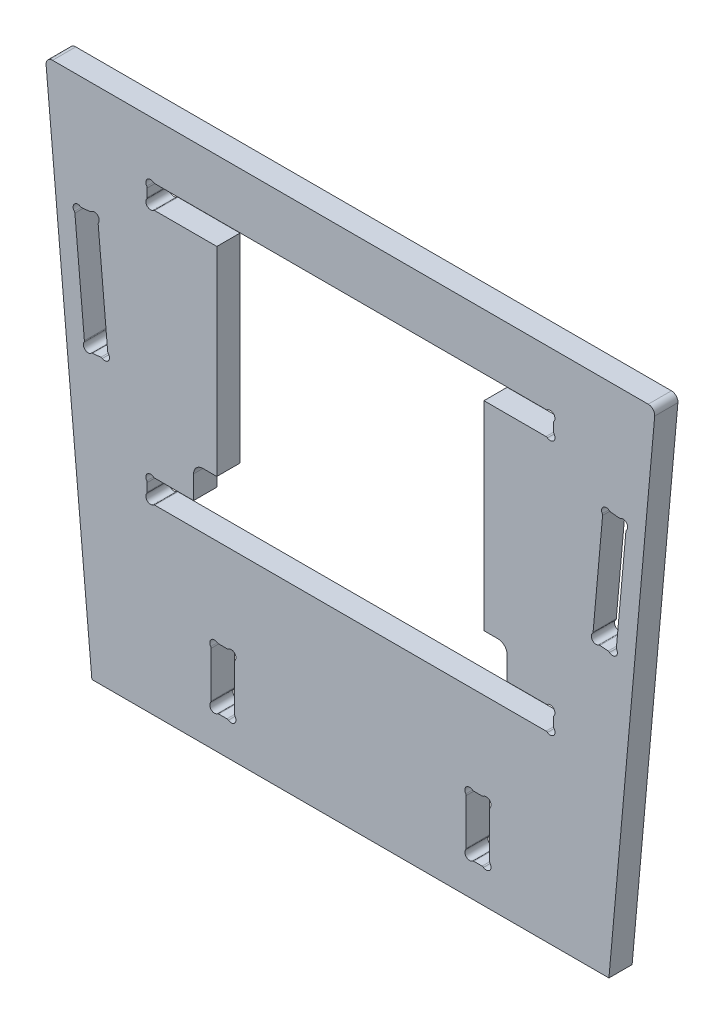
SolidWorks part; units mm, degrees
ref_plane "Front Plane" through (0, 0, 0) normal (0, 0, 1) x (1, 0, 0)
ref_plane "Top Plane" through (0, 0, 0) normal (0, 1, 0) x (1, 0, 0)
ref_plane "Right Plane" through (0, 0, 0) normal (1, 0, 0) x (0, 0, -1)
sketch "Sketch1" plane through (0, 0, 0) normal (0, 0, 1) x (1, 0, 0)
  line L0 (0, 0) -> (-50, 556.5)
  line L2 (278.5, 0) -> (0, 0)
  line L3 (-50, 556.5) -> (278.5, 556.5)
  line L4 (72.2163, 483.9) -> (59.6163, 483.9) construction
  line L5 (134.6163, 471.3) -> (67.7473, 471.3)
  line L6 (278.5, 496.5) -> (67.7473, 496.5)
  line L7 (59.6163, 488.369) -> (59.6163, 479.431)
  line L8 (59.6163, 496.5) -> (72.2163, 483.9) construction
  line L9 (72.2163, 209.1) -> (59.6163, 209.1) construction
  line L10 (278.5, 196.5) -> (67.7473, 196.5)
  line L11 (-50, 556.5) -> (-50, 0) construction
  line L12 (59.6163, 213.569) -> (59.6163, 204.631)
  line L13 (59.6163, 221.7) -> (72.2163, 209.1) construction
  line L14 (134.6163, 471.3) -> (134.6163, 256.7)
  line L15 (278.5, 556.5) -> (278.5, 496.5)
  line L16 (278.5, 196.5) -> (278.5, 0)
  line L17 (109.6163, 221.7) -> (67.7473, 221.7)
  line L18 (0, 0) -> (557, 0) construction
  line L19 (-49.3148, 556.5) -> (1124.6852, 556.5) construction
  line L20 (134.6163, 256.7) -> (119.6163, 256.7)
  line L21 (109.6163, 246.7) -> (109.6163, 221.7)
  line L22 (419.1275, 321.6195) -> (139.4282, 334.5926) construction
  line L23 (257.7921, 496.5) -> (257.7921, 486.5) construction
  line L25 (257.7921, 486.5) -> (257.7921, 206.5) construction
  line L26 (278.5, 496.5) -> (278.5, 196.5) construction
  line L31 (134.7163, 413.4756) -> (134.7163, 346.5) construction
  line L32 (257.7921, 206.5) -> (257.7921, 196.5) construction
  line L33 (422.2837, 346.5) -> (421.1254, 321.5268) construction
  line L34 (422.2837, 346.5) -> (165.5597, 358.4074) construction
  line L35 (421.1254, 321.5268) -> (419.1275, 321.6195) construction
  line L36 (140.5865, 359.5657) -> (139.4282, 334.5926) construction
  line L37 (139.4282, 334.5926) -> (165.5597, 358.4074) construction
  line L38 (422.2837, 346.5) -> (134.7163, 346.5) construction
  line L39 (165.5597, 358.4074) -> (140.5865, 359.5657) construction
  arc A0 (66.2589, 496.9914) -> (59.1249, 489.8574) centre (63.2225, 492.8938) ccw
  arc A1 (66.2589, 496.9914) -> (67.7473, 496.5) centre (67.7473, 499) ccw
  arc A2 (59.1249, 489.8574) -> (59.6163, 488.369) centre (57.1163, 488.369) cw
  arc A3 (59.1249, 477.9426) -> (59.6163, 479.431) centre (57.1163, 479.431) ccw
  arc A4 (66.2589, 470.8086) -> (59.1249, 477.9426) centre (63.2225, 474.9062) cw
  arc A5 (66.2589, 470.8086) -> (67.7473, 471.3) centre (67.7473, 468.8) cw
  arc A6 (66.2589, 222.1914) -> (59.1249, 215.0574) centre (63.2225, 218.0938) ccw
  arc A7 (66.2589, 222.1914) -> (67.7473, 221.7) centre (67.7473, 224.2) ccw
  arc A8 (59.1249, 215.0574) -> (59.6163, 213.569) centre (57.1163, 213.569) cw
  arc A9 (59.1249, 203.1426) -> (59.6163, 204.631) centre (57.1163, 204.631) ccw
  arc A10 (66.2589, 196.0086) -> (59.1249, 203.1426) centre (63.2225, 200.1062) cw
  arc A11 (66.2589, 196.0086) -> (67.7473, 196.5) centre (67.7473, 194) cw
  arc A12 (119.6163, 256.7) -> (109.6163, 246.7) centre (119.6163, 246.7) ccw
  circle A13 centre (152.494, 346.5) radius 17.6777 construction
  circle A14 centre (152.494, 346.5) radius 17.7777 construction
  point P19 (59.6163, 483.9)
  point P40 (59.6163, 209.1)
  point P46 (278.5, 0)
  point P80 (278.5, 346.5)
extrude "Boss-Extrude1" add sketch "Sketch1" along normal blind 25 contours L2 L0 L3 L15 L6 A1 A0 A2 L7 A3 A4 A5 L5 L14 L20 A12 L21 L17 A7 A6 A8 L12 A9 A10 A11 L10 L16
sketch "Sketch2" plane through (0, 0, 0) normal (0, 0, 1) x (1, 0, 0)
  line L0 (32.6309, 0) -> (5.2203, 305.0807) construction
  line L1 (278.5, 0) -> (0, 0) construction
  line L3 (278.5, 0) -> (0, 0) construction
  line L4 (6.8103, 428.1858) -> (17.0421, 314.3066)
  line L5 (-13.1727, 368.9912) -> (11.9262, 371.2462) construction
  line L6 (-18.2886, 425.9308) -> (-8.0568, 312.0516)
  line L7 (0.7692, 304.6808) -> (9.6713, 305.4806)
  line L8 (-10.9178, 434.7568) -> (-2.0157, 435.5566)
  line L9 (-4.0601, 307.8676) -> (-7.3292, 303.9531) construction
  line L10 (108.5, 0) -> (108.5, 196.5) construction
  line L11 (0, 0) -> (-50, 556.5) construction
  line L12 (278.5, 0) -> (0, 0) construction
  line L13 (6.0827, 436.2842) -> (-4.7183, 556.5) construction
  line L14 (-50, 556.5) -> (278.5, 556.5) construction
  line L15 (278.5, 196.5) -> (67.7473, 196.5) construction
  line L16 (278.5, 196.5) -> (278.5, 0) construction
  line L17 (6.0917, 436.1846) -> (-19.0072, 433.9296) construction
  line L18 (-18.9166, 434.0381) -> (-7.2296, 303.9621) construction
  line L19 (0, 0) -> (-50, 556.5) construction
  line L28 (141.1, 88.9) -> (141.1, 101.5) construction
  line L29 (128.5, 44.231) -> (128.5, 93.369)
  line L30 (145.569, 36.1) -> (136.631, 36.1)
  line L31 (153.7, 68.8) -> (128.5, 68.8) construction
  line L32 (153.7, 44.231) -> (153.7, 93.369)
  line L33 (145.569, 101.5) -> (136.631, 101.5)
  line L34 (153.7, 101.5) -> (141.1, 88.9) construction
  arc A0 (-8.413, 310.5251) -> (-0.6693, 304.0582) centre (-4.0601, 307.8676) ccw
  arc A1 (-8.413, 310.5251) -> (-8.0568, 312.0516) centre (-10.5468, 311.8278) ccw
  arc A2 (-0.6693, 304.0582) -> (0.7692, 304.6808) centre (0.9929, 302.1908) cw
  arc A3 (11.1977, 305.1244) -> (9.6713, 305.4806) centre (9.895, 302.9906) ccw
  arc A5 (17.6647, 312.8682) -> (11.1977, 305.1244) centre (13.8552, 309.4773) cw
  arc A7 (17.6647, 312.8682) -> (17.0421, 314.3066) centre (19.5321, 314.5303) cw
  arc A8 (7.1665, 429.7122) -> (6.8103, 428.1858) centre (9.3003, 428.4095) ccw
  arc A9 (7.1665, 429.7122) -> (-0.5772, 436.1792) centre (2.8137, 432.3698) ccw
  arc A10 (-0.5772, 436.1792) -> (-2.0157, 435.5566) centre (-2.2394, 438.0466) cw
  arc A11 (-12.4442, 435.113) -> (-10.9178, 434.7568) centre (-11.1415, 437.2468) ccw
  arc A12 (-18.9111, 427.3692) -> (-12.4442, 435.113) centre (-15.1017, 430.7601) cw
  arc A13 (-18.9111, 427.3692) -> (-18.2886, 425.9308) centre (-20.7785, 425.707) cw
  arc A38 (154.1914, 94.8574) -> (147.0574, 101.9914) centre (150.0938, 97.8938) ccw
  arc A39 (154.1914, 94.8574) -> (153.7, 93.369) centre (156.2, 93.369) ccw
  arc A40 (147.0574, 101.9914) -> (145.569, 101.5) centre (145.569, 104) cw
  arc A41 (135.1426, 101.9914) -> (136.631, 101.5) centre (136.631, 104) ccw
  arc A42 (128.0086, 94.8574) -> (135.1426, 101.9914) centre (132.1062, 97.8938) cw
  arc A43 (128.0086, 94.8574) -> (128.5, 93.369) centre (126, 93.369) cw
  arc A44 (128.0086, 42.7426) -> (128.5, 44.231) centre (126, 44.231) ccw
  arc A45 (128.0086, 42.7426) -> (135.1426, 35.6086) centre (132.1062, 39.7062) ccw
  arc A46 (135.1426, 35.6086) -> (136.631, 36.1) centre (136.631, 33.6) cw
  arc A47 (147.0574, 35.6086) -> (145.569, 36.1) centre (145.569, 33.6) ccw
  arc A48 (154.1914, 42.7426) -> (147.0574, 35.6086) centre (150.0938, 39.7062) cw
  arc A49 (154.1914, 42.7426) -> (153.7, 44.231) centre (156.2, 44.231) cw
  point P21 (5.2203, 305.0807)
  point P126 (141.1, 101.5)
extrude "Cut-Extrude1" cut sketch "Sketch2" along normal through all
fillet "Fillet1" radius 7 1 edges at (-50, 556.5, 12.5)
mirror "Symétrie1" about plane through (278.5, 556.5, 25) normal (1, 0, 0)
ref_plane "Plane1" through (278.5, 0, 0) normal (-1, 0, 0) x (0, 0, 1)
equation "\"tool_diameter\"=10"
equation "\"hole_clearance\"=0.1"
equation "\"material_thickness\"=25"
equation "\"clearance\"=0.1"
equation "\"outer_slot\"=0.5"
equation "\"fillet\"=7"
equation "\"D1@Boss-Extrude1\"=\"material_thickness\""
equation "\"D7@Sketch2\"=\"tool_diameter\"/2+\"hole_clearance\""
equation "\"D4@Sketch2\"= \"material_thickness\" / 10"
equation "\"D6@Sketch2\"=\"material_thickness\"/2+\"clearance\""
equation "\"string\"= 2 * \"tool_diameter\" / 2 * cos ( 45deg )"
equation "\"angle\"= IIF ( \"string\" < \"limit\" , 45 , ( 180 - 2 * arcsin ( \"ThicknessVStool_dia\" ) ) / 2 )"
equation "\"limit\"= \"material_thickness\" / 2 * 5 / 6"
equation "\"ThicknessVStool_dia\"= IIF ( \"limit\" / \"tool_diameter\" > 1 , 1 , \"limit\" / \"tool_diameter\" )"
equation "\"D3@Sketch2\"=\"angle\""
equation "\"D20@Sketch2\"=\"tool_diameter\" / 2 + \"hole_clearance\""
equation "\"D19@Sketch2\" = \"material_thickness\" / 2 + \"clearance\""
equation "\"D21@Sketch2\"=\"material_thickness\"/10"
equation "\"D17@Sketch2\"=\"angle\""
equation "\"D1@Fillet1\"=\"fillet\""
equation "\"D4@Sketch1\"=\"tool_diameter\" / 2 + \"hole_clearance\""
equation "\"D3@Sketch1\" = \"material_thickness\" / 2 + \"clearance\""
equation "\"D5@Sketch1\"=\"material_thickness\"/10"
equation "\"D8@Sketch1\"=\"tool_diameter\" / 2 + \"hole_clearance\""
equation "\"D9@Sketch1\"=\"material_thickness\"/10"
equation "\"D11@Sketch1\"=\"material_thickness\"/2 + \"clearance\""
equation "\"D14@Sketch1\"=(1220 - 2*13 - \"tool_diameter\"*2 - 50)/2  - \"tool_diameter\"/2"
equation "\"D16@Sketch1\"=\"clearance\""
equation "\"D7@Sketch1\"=(2440 - 8*13 - \"tool_diameter\"*11)/4"
equation "\"D17@Sketch1\"=\"material_thickness\"*3 "
equation "\"D9@Sketch2\"=40 +\"clearance\"*2 +\"material_thickness\""
equation "\"D12@Sketch2\"=20 + \"material_thickness\"/2 + \"clearance\"+\"clearance\""
equation "\"D18@Sketch1\"=\"tool_diameter\""
equation "\"D19@Sketch1\"=\"material_thickness\""
equation "\"D21@Sketch1\"= \"clearance\""
equation "\"D14@Sketch2\"=\"clearance\""
equation "\"D15@Sketch2\"=\"clearance\""
equation "\"D6@Sketch1\"=\"angle\""
equation "\"D1@Sketch1\"=\"angle\""
equation "\"D13@Sketch1\"=\"material_thickness\""
equation "\"D15@Sketch1\"=\"material_thickness\"+10"
equation "\"D20@Sketch1\"=\"tool_diameter\""
